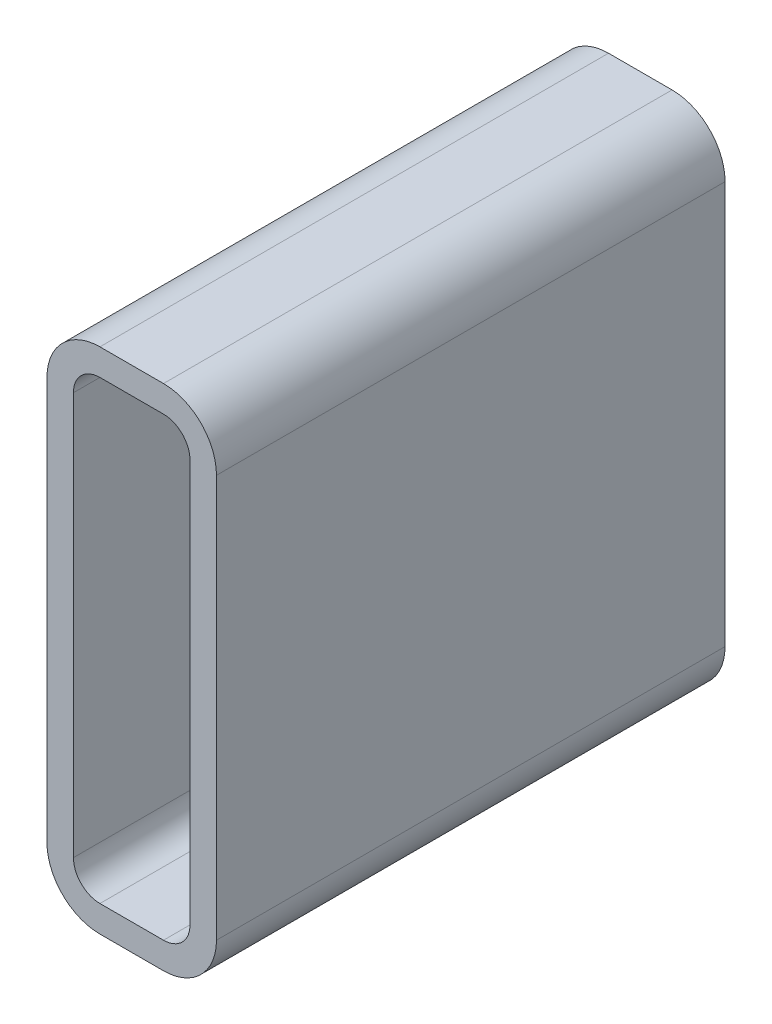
SolidWorks part; units mm, degrees
ref_plane "Front Plane" through (0, 0, 0) normal (0, 0, 1) x (1, 0, 0)
ref_plane "Top Plane" through (0, 0, 0) normal (0, 1, 0) x (1, 0, 0)
ref_plane "Right Plane" through (0, 0, 0) normal (1, 0, 0) x (0, 0, -1)
sketch "Sketch1" plane through (0, 0, 0) normal (0, 0, 1) x (1, 0, 0)
sketch_block_instance "HSS12x4x0.625-1"
sketch_block "HSS12x4x0.625"
extrude "Boss-Extrude1" add sketch "Sketch1" along normal blind 304.8
